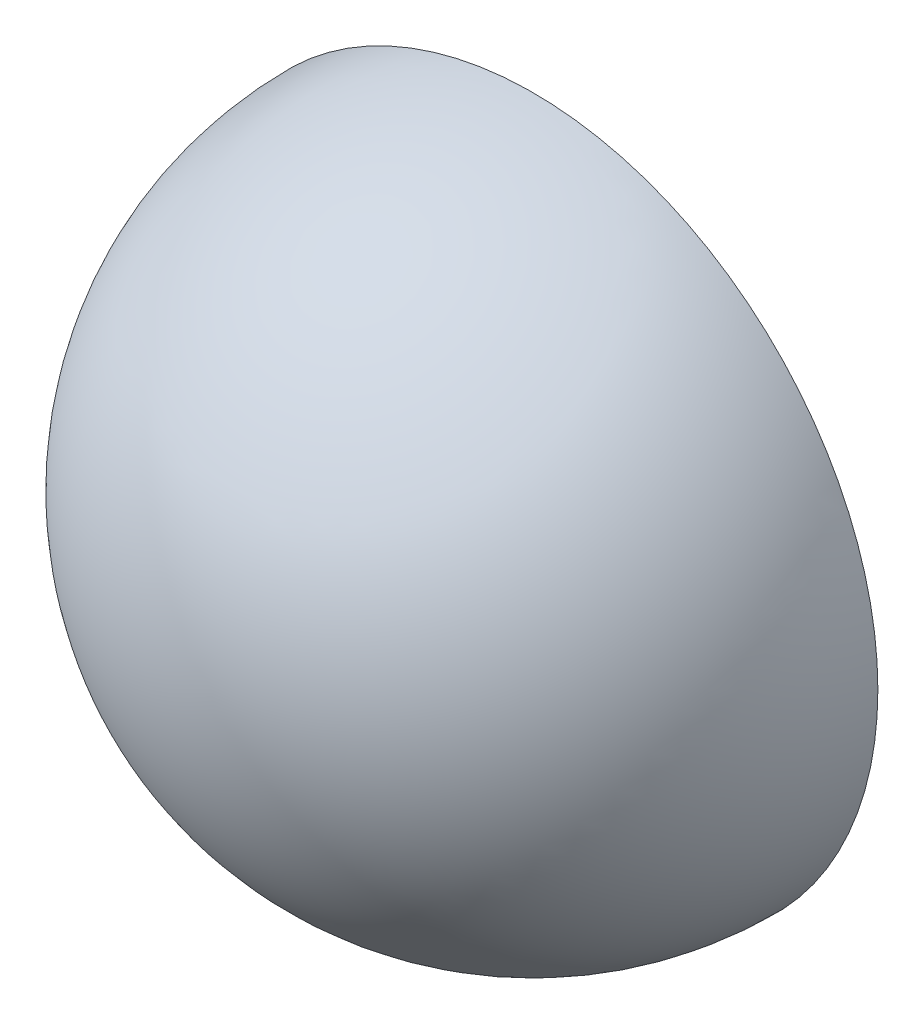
SolidWorks part; units mm, degrees
ref_plane "Front Plane" through (0, 0, 0) normal (0, 0, 1) x (1, 0, 0)
ref_plane "Top Plane" through (0, 0, 0) normal (0, 1, 0) x (1, 0, 0)
ref_plane "Right Plane" through (0, 0, 0) normal (1, 0, 0) x (0, 0, -1)
sketch "Sketch1" plane through (0, 0, 0) normal (0, 0, 1) x (1, 0, 0)
  line L0 (0, 0) -> (2.2427, 0) construction
  line L1 (0, 0) -> (0, 4.8723) construction
  line L2 (1.25, 0) -> (-1.25, 0)
  arc A0 (1.25, 0) -> (-1.25, 0) centre (0, 0) ccw
  dimension "D1" = 2.5
revolve "Revolve1" add sketch "Sketch1" angle 180 about L0
sketch "Sketch2" plane through (0, 0, 0) normal (0, 0, -1) x (-1, 0, 0)
  circle A0 centre (0, 0) radius 1
  dimension "D1" = 2
extrude "Cut-Extrude1" cut sketch "Sketch2" against normal blind 0.5
